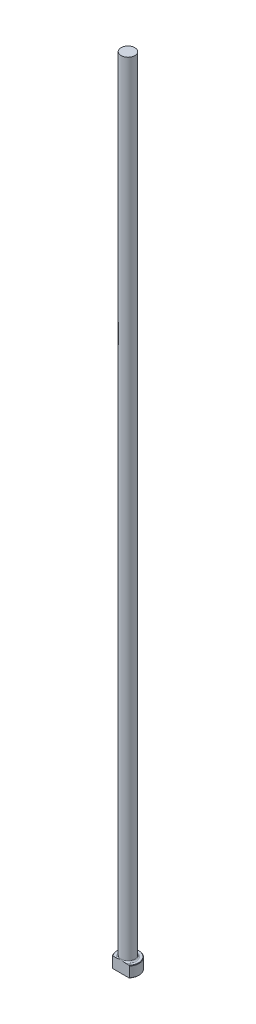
SolidWorks part; units mm, degrees
ref_plane "Front Plane" through (0, 0, 0) normal (0, 0, 1) x (1, 0, 0)
ref_plane "Top Plane" through (0, 0, 0) normal (0, 1, 0) x (1, 0, 0)
ref_plane "Right Plane" through (0, 0, 0) normal (1, 0, 0) x (0, 0, -1)
sketch "Sketch1" plane through (0, 0, 0) normal (0, 0, 1) x (1, 0, 0)
  line L0 (0, 259.9588) -> (0, -15.1925) construction
  line L1 (0, 0) -> (-6.35, 0)
  line L2 (-6.35, 0) -> (-6.35, 6.35)
  line L3 (-6.35, 6.35) -> (-3.9687, 6.35)
  line L4 (-3.9687, 6.35) -> (-3.9687, 457.2)
  line L5 (-3.9687, 457.2) -> (0, 457.2)
  line L6 (0, 457.2) -> (0, 0)
  dimension "L" = 457.2
  dimension "H" = 12.7
  dimension "T" = 6.35
  dimension "D" = 7.9375
revolve "Revolve1" add sketch "Sketch1" angle 360 about L0
chamfer "Chamfer1" distance 0.254 angle 45 2 edges at (0, 6.35, 6.35) (0, 0, 6.35)
fillet "Fillet1" radius 0.762 1 edges at (0, 6.35, 3.9687)
sketch "Sketch2" plane through (0, 0, 0) normal (0, -1, 0) x (1, 0, 0)
  line L0 (-4.957, 3.9687) -> (4.957, 3.9687)
  arc A0 (4.957, 3.9687) -> (-4.957, 3.9687) centre (0, 0) ccw
  circle A1 centre (0, 0) radius 6.35 construction
  circle A3 centre (0, 0) radius 3.9687 construction
extrude "KEY" cut sketch "Sketch2" against normal through all
sketch "Pocket Sketch" plane through (0, 0, 0) normal (0, 0, 1) x (1, 0, 0)
  line L0 (-6.7469, 0) -> (-6.7469, 6.3754)
  line L1 (-6.7469, 6.3754) -> (-5.1276, 6.3754)
  line L2 (-4.3656, 7.1374) -> (-4.3656, 22.225)
  line L3 (-4.3656, 22.225) -> (0, 22.225)
  line L4 (0, 22.225) -> (0, 0)
  line L5 (0, 0) -> (-6.7469, 0)
  line L6 (0, 12.6104) -> (0, -2.4989) construction
  line L7 (-6.35, 6.096) -> (-6.35, 0.254) construction
  line L8 (6.096, 6.35) -> (-6.096, 6.35) construction
  line L9 (-3.9687, 457.2) -> (-3.9687, 7.112) construction
  line L10 (-5.1276, 6.3754) -> (-4.3656, 7.1374)
  point P3 (-4.3656, 6.3754)
  dimension "D1" = 13.4937
  dimension "D2" = 0.3969
  dimension "D3" = 0.0254
  dimension "D4" = 0.3969
  dimension "D5" = 8.7312
  dimension "D6" = 22.225
